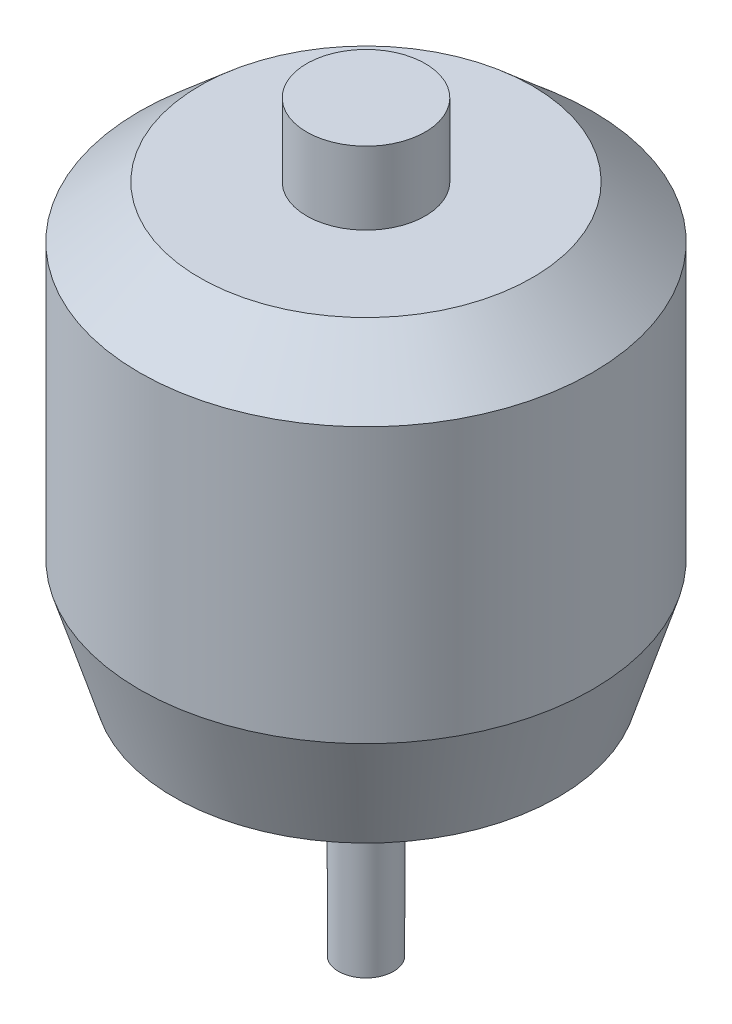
SolidWorks part; units mm, degrees
ref_plane "Front Plane" through (0, 0, 0) normal (0, 0, 1) x (1, 0, 0)
ref_plane "Top Plane" through (0, 0, 0) normal (0, 1, 0) x (1, 0, 0)
ref_plane "Right Plane" through (0, 0, 0) normal (1, 0, 0) x (0, 0, -1)
sketch "Sketch1" plane through (0, 0, 0) normal (0, 1, 0) x (1, 0, 0)
  circle A0 centre (0, 0) radius 20.955
  dimension "D1" = 41.91
extrude "Boss-Extrude1" add sketch "Sketch1" along normal blind 25.4
sketch "Sketch2" plane through (0, 0, 0) normal (1, 0, 0) x (0, 0, -1)
  line L0 (0, -974.6) -> (0, 49025.4) construction
  line L1 (20.955, 25.4) -> (-20.955, 25.4) construction
  line L2 (0, 25.4) -> (20.955, 25.4)
  line L3 (20.955, 25.4) -> (15.3924, 30.226)
  line L4 (15.3924, 30.226) -> (0, 30.226)
  line L5 (0, 30.226) -> (0, 25.4)
  point P5 (0, 25.4)
  dimension "D1" = 4.826
  dimension "D2" = 15.3924
revolve "Revolve1" add sketch "Sketch2" angle 360 about L0
sketch "Sketch3" plane through (0, 30.226, 0) normal (0, 1, 0) x (1, 0, 0)
  circle A0 centre (0, 0) radius 5.4864
  dimension "D1" = 10.9728
extrude "Boss-Extrude2" add sketch "Sketch3" along normal blind 6.731
sketch "Sketch4" plane through (0, 0, 0) normal (0, 0, 1) x (1, 0, 0)
  line L0 (0, -1000) -> (0, 49000) construction
  line L1 (0, 0) -> (0, -10.2108)
  line L2 (0, -10.2108) -> (-17.78, -10.2108)
  line L3 (-17.78, -10.2108) -> (-20.955, 0)
  line L4 (-20.955, 0) -> (0, 0)
  dimension "D1" = 10.2108
  dimension "D2" = 17.78
revolve "Revolve2" add sketch "Sketch4" angle 360 about L0
sketch "Sketch5" plane through (0, -10.2108, 0) normal (0, -1, 0) x (1, 0, 0)
  circle A0 centre (0, 0) radius 2.54
  dimension "D1" = 5.08
extrude "Boss-Extrude3" add sketch "Sketch5" along normal blind 21.59
sketch "Sketch6" plane through (0, -10.2108, 0) normal (0, -1, 0) x (1, 0, 0)
  line L0 (-8.9803, 8.9803) -> (8.9803, -8.9803) construction
  line L1 (-12.7, 0) -> (12.7, 0) construction
  circle A0 centre (0, 0) radius 12.7 construction
  circle A1 centre (0, 0) radius 17.78 construction
  circle A2 centre (-8.9803, 8.9803) radius 1.27
  circle A3 centre (8.9803, 8.9803) radius 1.27
  circle A4 centre (8.9803, -8.9803) radius 1.27
  circle A5 centre (-8.9803, -8.9803) radius 1.27
  point P12 (0, 0)
  dimension "D1" = 5.08
  dimension "D2" = 2.54
  dimension "D3" = 45
  dimension "D4" = 4
extrude "Cut-Extrude1" cut sketch "Sketch6" against normal blind 12.7
